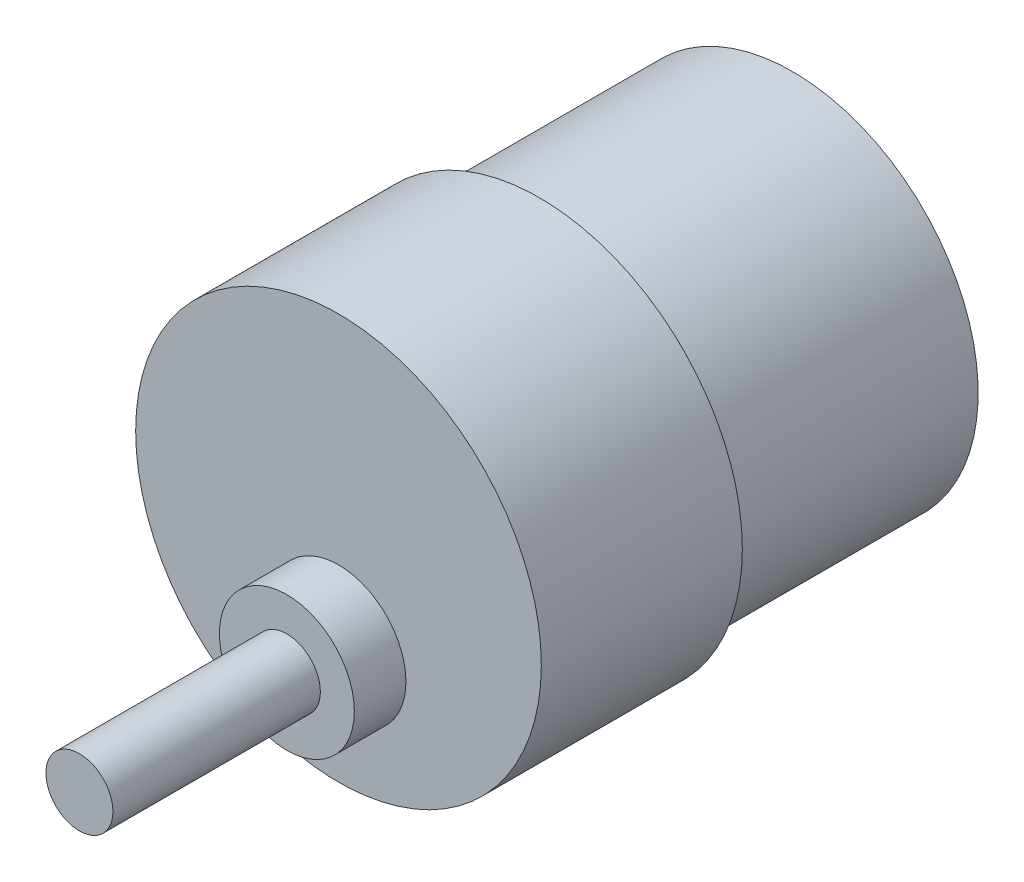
SolidWorks part; units mm, degrees
ref_plane "Front" through (0, 0, 0) normal (0, 0, 1) x (1, 0, 0)
ref_plane "Top" through (0, 0, 0) normal (0, 1, 0) x (1, 0, 0)
ref_plane "Right" through (0, 0, 0) normal (1, 0, 0) x (0, 0, -1)
sketch "Sketch1" plane through (0, 0, 0) normal (0, 0, 1) x (1, 0, 0)
  circle A0 centre (0, 0) radius 16.5735
  dimension "D1" = 33.147
extrude "Boss-Extrude1" add sketch "Sketch1" along normal blind 22.606
sketch "Sketch2" plane through (0, 0, 22.606) normal (0, 0, 1) x (1, 0, 0)
  circle A0 centre (0, 0) radius 18.1166
  dimension "D1" = 36.2331
extrude "Boss-Extrude2" add sketch "Sketch2" along normal blind 17.9578
sketch "Sketch3" plane through (0, 0, 40.5638) normal (0, 0, 1) x (1, 0, 0)
  line L0 (0, 18.1166) -> (0, -18.1166) construction
  line L1 (0, -1.3018) -> (0, -13.3541) construction
  circle A0 centre (0, -7.3279) radius 6.0261
  circle A2 centre (0, 0) radius 18.1166 construction
  dimension "D1" = 12.0523
  dimension "D2" = 7.3279
  dimension "D3" = 4.7625
extrude "Boss-Extrude3" add sketch "Sketch3" along normal blind 4.6101
sketch "Sketch5" plane through (0, 0, 45.1739) normal (0, 0, 1) x (1, 0, 0)
  circle A0 centre (0, -7.3279) radius 2.9908
  dimension "D1" = 5.9817
extrude "Boss-Extrude4" add sketch "Sketch5" along normal blind 18.5293
